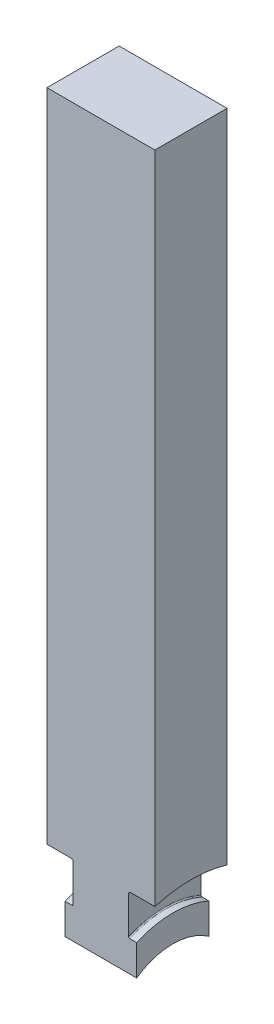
SolidWorks part; units mm, degrees
ref_plane "Front Plane" through (0, 0, 0) normal (0, 0, 1) x (1, 0, 0)
ref_plane "Top Plane" through (0, 0, 0) normal (0, 1, 0) x (1, 0, 0)
ref_plane "Right Plane" through (0, 0, 0) normal (1, 0, 0) x (0, 0, -1)
sketch "Sketch1" plane through (0, 0, 0) normal (1, 0, 0) x (0, 0, -1)
  line L0 (-12.827, 276.225) -> (-12.827, 0)
  line L1 (0, 249.2329) -> (0, 0) construction
  line L2 (12.827, 276.225) -> (12.827, 0)
  line L3 (-12.827, 276.225) -> (12.827, 276.225)
  line L6 (-12.827, 0) -> (12.827, 0)
  arc A0 (-22.225, 0) -> (22.225, 0) centre (0, 0) cw construction
  dimension "R" = 22.225
  dimension "L" = 254
  dimension "T" = 25.654
extrude "Boss-Extrude1" add sketch "Sketch1" along normal mid plane 38.354
sketch "Sketch8" plane through (0, 0, 0) normal (1, 0, 0) x (0, 0, -1)
  circle A0 centre (0, 0) radius 22.225
  arc A1 (22.225, 0) -> (-22.225, 0) centre (0, 0) ccw construction
extrude "Cut-Extrude4" cut sketch "Sketch8" against normal through all both and the other way through all
sketch "Sketch2" plane through (0, 0, 0) normal (0, 0, 1) x (1, 0, 0)
  line L0 (19.177, 31.75) -> (9.8552, 31.75)
  line L1 (19.177, 276.225) -> (19.177, 18.1499) construction
  line L2 (9.8552, 31.75) -> (9.8552, 45.2374)
  line L3 (9.8552, 45.2374) -> (19.177, 45.2374)
  line L4 (19.177, 45.2374) -> (19.177, 31.75)
  line L5 (0, 29.9173) -> (0, 0) construction
  line L6 (-19.177, 45.2374) -> (-19.177, 31.75)
  line L7 (-9.8552, 45.2374) -> (-19.177, 45.2374)
  line L8 (-9.8552, 31.75) -> (-9.8552, 45.2374)
  line L9 (-19.177, 31.75) -> (-9.8552, 31.75)
  line L10 (-8.8482, 0) -> (24.5305, 0) construction
  dimension "D1" = 19.7104
  dimension "D2" = 45.2374
  dimension "D3" = 31.75
revolve "Cut-Revolve1" cut sketch "Sketch2" angle 360 about L10
sketch "Sketch7" plane through (0, 0, 0) normal (0, 0, 1) x (1, 0, 0)
  line L6 (-19.177, 31.75) -> (-12.7, 31.75)
  line L8 (-19.177, 31.75) -> (-19.177, 0)
  line L9 (-19.177, 0) -> (-12.7, 0)
  line L10 (-12.7, 31.75) -> (-12.7, 0)
  line L11 (0, 16.5651) -> (0, 5.9342) construction
  line L12 (12.7, 31.75) -> (12.7, 0)
  line L13 (19.177, 0) -> (12.7, 0)
  line L14 (19.177, 31.75) -> (19.177, 0)
  line L15 (19.177, 31.75) -> (12.7, 31.75)
  dimension "MW" = 25.4
extrude "Cut-Extrude3" cut sketch "Sketch7" against normal through all both and the other way through all
fillet "Fillet1" radius 0.762 2 edges at (-9.8552, 45.2374, 0) (9.8552, 45.2374, 0)
fillet "Fillet2" radius 0.381 2 edges at (-9.8552, 31.75, 0) (9.8552, 31.75, 0)
